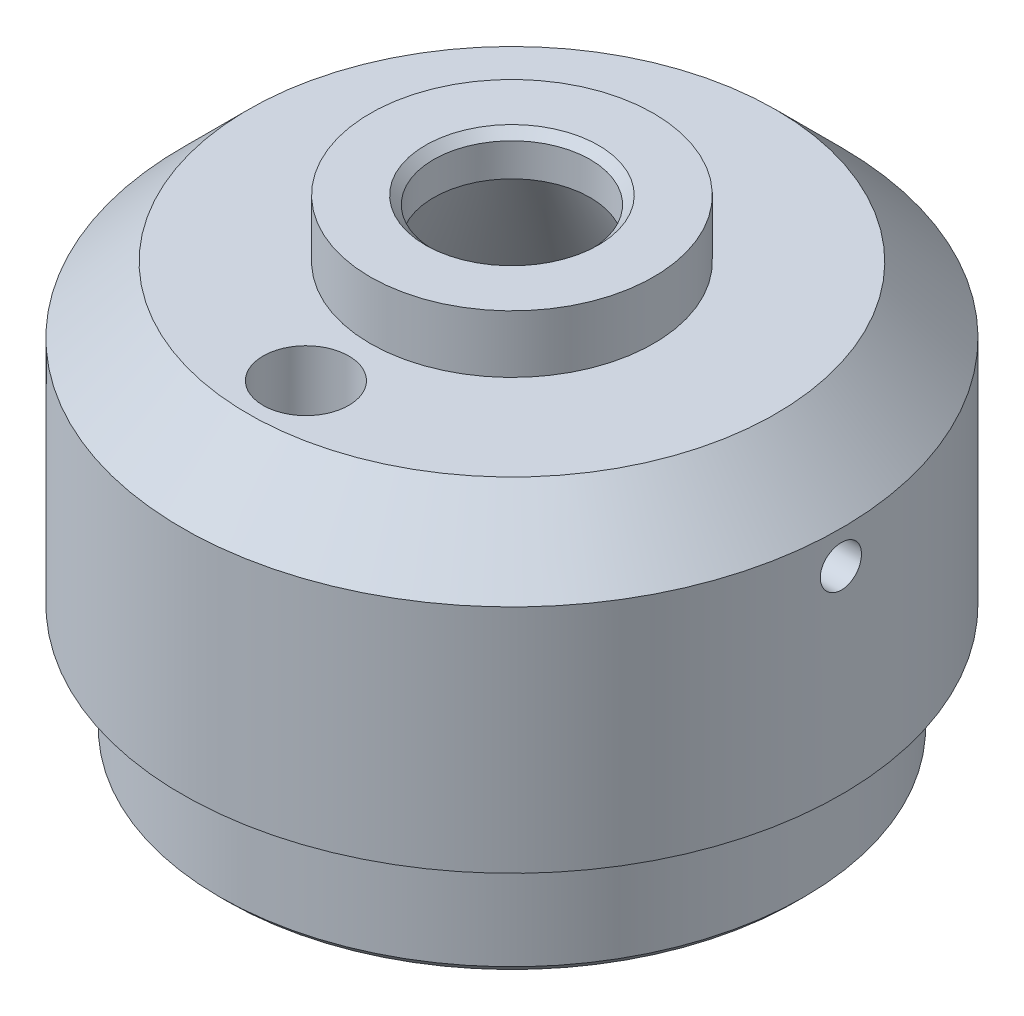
SolidWorks part; units mm, degrees
ref_plane "Plan1" through (0, 0, 0) normal (0, 0, 1) x (1, 0, 0)
ref_plane "Plan2" through (0, 0, 0) normal (0, 1, 0) x (1, 0, 0)
ref_plane "Plan3" through (0, 0, 0) normal (1, 0, 0) x (0, 0, -1)
sketch "Esquisse1" plane through (0, 0, 0) normal (0, 0, 1) x (1, 0, 0)
  line L0 (16.25, 0) -> (17.75, 0)
  line L1 (17.75, 0) -> (17.75, 7)
  line L2 (17.75, 7) -> (20, 7)
  line L3 (20, 7) -> (20, 21)
  line L4 (20, 21) -> (16, 25)
  line L5 (16, 25) -> (8.6, 25)
  line L6 (8.6, 25) -> (8.6, 28.5)
  line L7 (8.6, 28.5) -> (4.75, 28.5)
  line L8 (0, 0) -> (0, 13.2) construction
  line L9 (4.75, 28.5) -> (4.75, 26)
  line L10 (4.75, 26) -> (16.25, 3.2)
  line L11 (16.25, 3.2) -> (16.25, 0)
  dimension "D1" = 20
  dimension "D2" = 16.25
  dimension "D3" = 25
  dimension "D4" = 4
  dimension "D5" = 4
  dimension "D7" = 3.5
  dimension "D8" = 17.75
  dimension "D9" = 4.75
  dimension "D10" = 2.5
  dimension "D11" = 7
revolve "Base-Révolution" add sketch "Esquisse1" angle 360 about L8
chamfer "Chanfrein1" distance 0.5 angle 45
sketch "Esquisse2" plane through (0, 25, 0) normal (0, 1, 0) x (-1, 0, 0)
  circle A0 centre (0, 12.5) radius 2.6
  dimension "D2" = 5.2
  dimension "D1" = 12.5
extrude "Enlèv. mat.-Extru.1" cut sketch "Esquisse2" against normal blind 5
sketch "Esquisse3" plane through (0, 0, 0) normal (1, 0, 0) x (0, 0, -1)
  line L0 (-12.5, 20) -> (-12.5, 25.703) construction
  line L1 (-12.5, 20) -> (-12.5, 25) construction
  line L2 (-12.5, 20) -> (-9.9, 20)
  line L3 (-9.9, 20) -> (-15.1, 20) construction
  line L4 (-9.9, 20) -> (-12.5, 18.4989)
  line L5 (-12.5, 18.4989) -> (-12.5, 20)
  dimension "D1" = 150
revolve "Enlèvement de matière-Révolution1" cut sketch "Esquisse3" angle 360 about L0
ref_plane "Plan4" through (20, 0, 0) normal (1, 0, 0) x (0, 0, -1)
hole_wizard "Trou taraudé M3x0.51" positions "Esquisse5" profile "Esquisse4" tap size "M3x0.5" standard "ISO"
sketch "Esquisse5" plane through (20, 0, 0) normal (1, 0, 0) x (0, 0, -1)
  line L0 (16, 25) -> (-16, 25) construction
  point P0 (0, 19)
  dimension "D1" = 6
sketch "Esquisse4" plane through (20, 19, 0) normal (0, 1, 0) x (0, 0, -1)
  line L0 (0, 0) -> (0, 6.2511)
  line L1 (0, 6.2511) -> (1.25, 5.5)
  line L2 (1.25, 5.5) -> (1.25, 0)
  line L5 (1.25, 0) -> (0, 0)
  line L10 (0, 6.2511) -> (-1.25, 5.5) construction
  line L11 (0, -6.35) -> (0, 107.95) construction
  dimension "Diamètre du trou pour taraudage" = 2.5
  dimension "Profondeur du trou pour taraudage" = 5.5
  dimension "Angle de pointe" = 118
mirror "Symétrie2" about plane through (0, 0, 0) normal (1, 0, 0)
